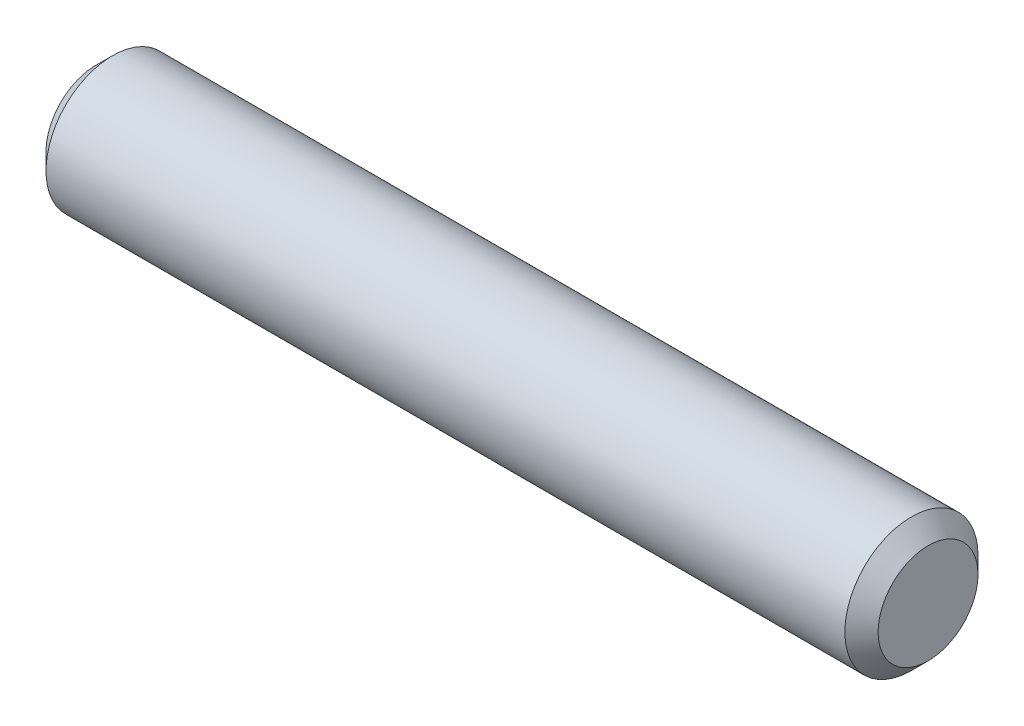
SolidWorks part; units mm, degrees
ref_plane "Plan1" through (0, 0, 0) normal (0, 0, 1) x (1, 0, 0)
ref_plane "Plan2" through (0, 0, 0) normal (0, 1, 0) x (1, 0, 0)
ref_plane "Plan3" through (0, 0, 0) normal (1, 0, 0) x (0, 0, -1)
sketch "Esquisse1" plane through (0, 0, 0) normal (1, 0, 0) x (0, 0, -1)
  circle A0 centre (0, 0) radius 2
extrude "Base-Extrusion" add sketch "Esquisse1" along normal blind 25
chamfer "Chanfrein1" distance 0.5 angle 45
